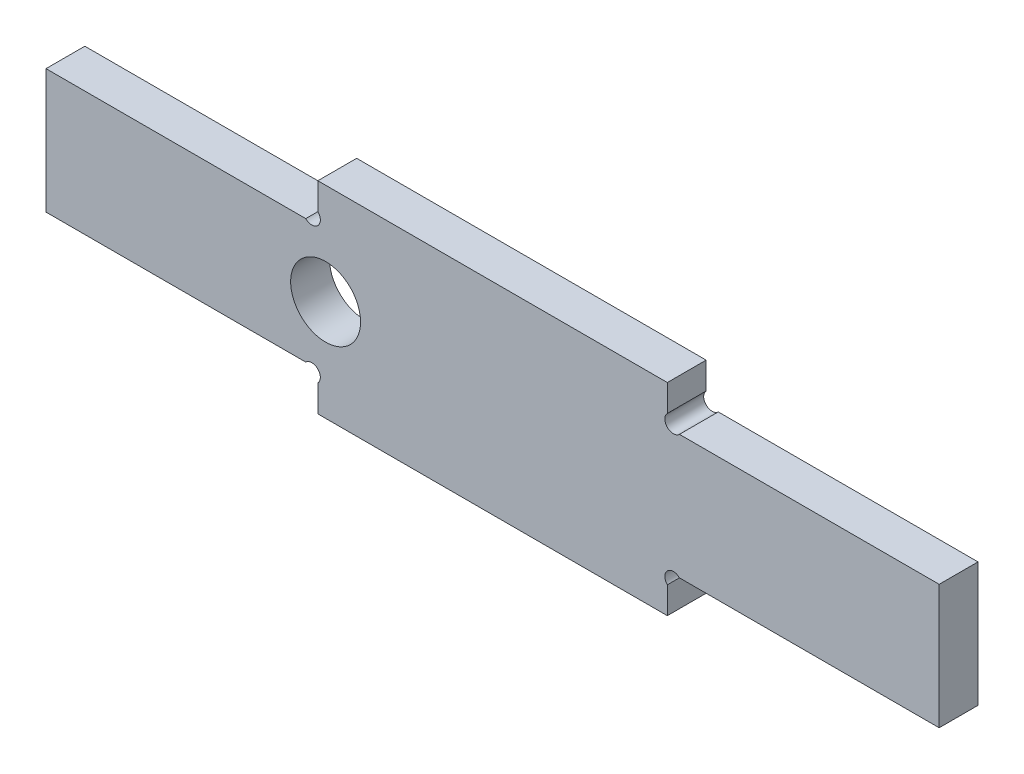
SolidWorks part; units mm, degrees
ref_plane "Plan de face" through (0, 0, 0) normal (0, 0, 1) x (1, 0, 0)
ref_plane "Plan de dessus" through (0, 0, 0) normal (0, 1, 0) x (1, 0, 0)
ref_plane "Plan de droite" through (0, 0, 0) normal (1, 0, 0) x (0, 0, -1)
sketch "Esquisse1" plane through (0, 0, 0) normal (0, 0, 1) x (1, 0, 0)
  line L1 (0, 0) -> (57.5, 0)
  line L2 (0, 0) -> (0, 26)
  line L3 (0, 26) -> (57.5, 26)
  line L4 (57.5, 0) -> (57.5, 26)
  dimension "D1" = 26
  dimension "D2" = 57.5
extrude "Boss.-Extru.1" add sketch "Esquisse1" along normal blind 5
sketch "Esquisse3" plane through (0, 0, 5) normal (0, 0, 1) x (1, 0, 0)
  line L1 (0, 26) -> (35, 26)
  line L2 (0, 26) -> (0, 21)
  line L3 (0, 21) -> (35, 21)
  line L4 (35, 26) -> (35, 21)
  line L5 (0, 0) -> (35, 0)
  line L6 (0, 0) -> (0, 5)
  line L7 (0, 5) -> (35, 5)
  line L8 (35, 0) -> (35, 5)
  dimension "D1" = 5
  dimension "D2" = 5
  dimension "D3" = 35
  dimension "D4" = 35
extrude "Enlèv. mat.-Extru.1" cut sketch "Esquisse3" against normal up to next
sketch "Esquisse5" plane through (0, 0, 5) normal (0, 0, 1) x (1, 0, 0)
  line L0 (35, 21) -> (26.1094, 29.8906) construction
  line L1 (35, 5) -> (27.6179, -2.3821) construction
  line L2 (0, 21) -> (35, 21) construction
  line L3 (35, 5) -> (0, 5) construction
  circle A0 centre (34.2222, 21.7778) radius 1.1
  circle A1 centre (34.2222, 4.2222) radius 1.1
  dimension "D3" = 2.2
  dimension "D4" = 2.2
  dimension "D1" = 45
  dimension "D2" = 45
extrude "Enlèv. mat.-Extru.3" cut sketch "Esquisse5" against normal up to next
mirror "Symétrie1" about plane through (57.5, 0, 5) normal (-1, 0, 0) of "Enlèv. mat.-Extru.3", "Enlèv. mat.-Extru.1", "Boss.-Extru.1"
sketch "Esquisse4" plane through (0, 0, 5) normal (0, 0, 1) x (1, 0, 0)
  line L0 (0, 21) -> (0, 5) construction
  line L1 (80, 26) -> (35, 26) construction
  circle A0 centre (36, 13) radius 4.5
  dimension "D1" = 9
  dimension "D2" = 36
  dimension "D3" = 13
extrude "Enlèv. mat.-Extru.2" cut sketch "Esquisse4" against normal up to next
